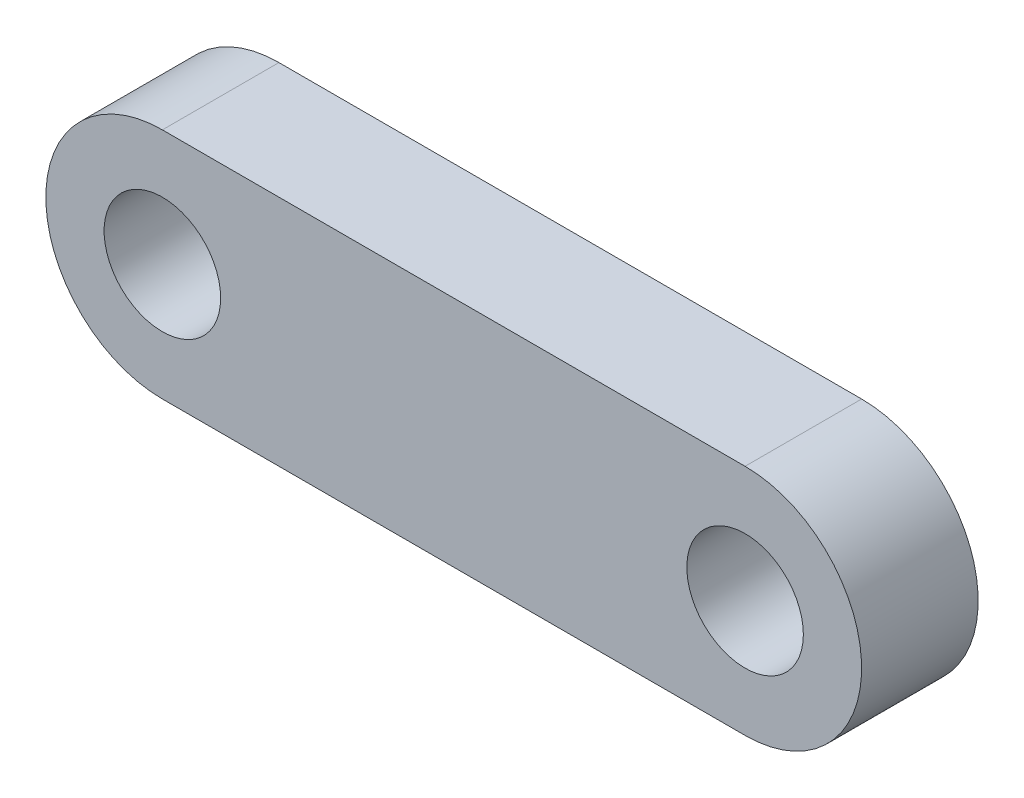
SolidWorks part; units mm, degrees
ref_plane "Plan1" through (0, 0, 0) normal (0, 0, 1) x (1, 0, 0)
ref_plane "Plan2" through (0, 0, 0) normal (0, 1, 0) x (1, 0, 0)
ref_plane "Plan3" through (0, 0, 0) normal (1, 0, 0) x (0, 0, -1)
sketch "Esquisse1" plane through (0, 0, 0) normal (0, 0, 1) x (1, 0, 0)
  line L0 (0, 10) -> (50, 10)
  line L1 (0, -10) -> (50, -10)
  circle A0 centre (0, 0) radius 5
  circle A1 centre (50, 0) radius 5
  arc A2 (0, 10) -> (0, -10) centre (0, 0) ccw
  arc A3 (50, -10) -> (50, 10) centre (50, 0) ccw
  dimension "D1" = 10
  dimension "D2" = 10
  dimension "D3" = 50
  dimension "D4" = 20
  dimension "D5" = 20
extrude "Base-Extrusion" add sketch "Esquisse1" along normal mid plane 10
sketch "Esquisse4" plane through (0, 0, 0) normal (0, 0, 1) x (1, 0, 0)
  point P0 (0, 0)
